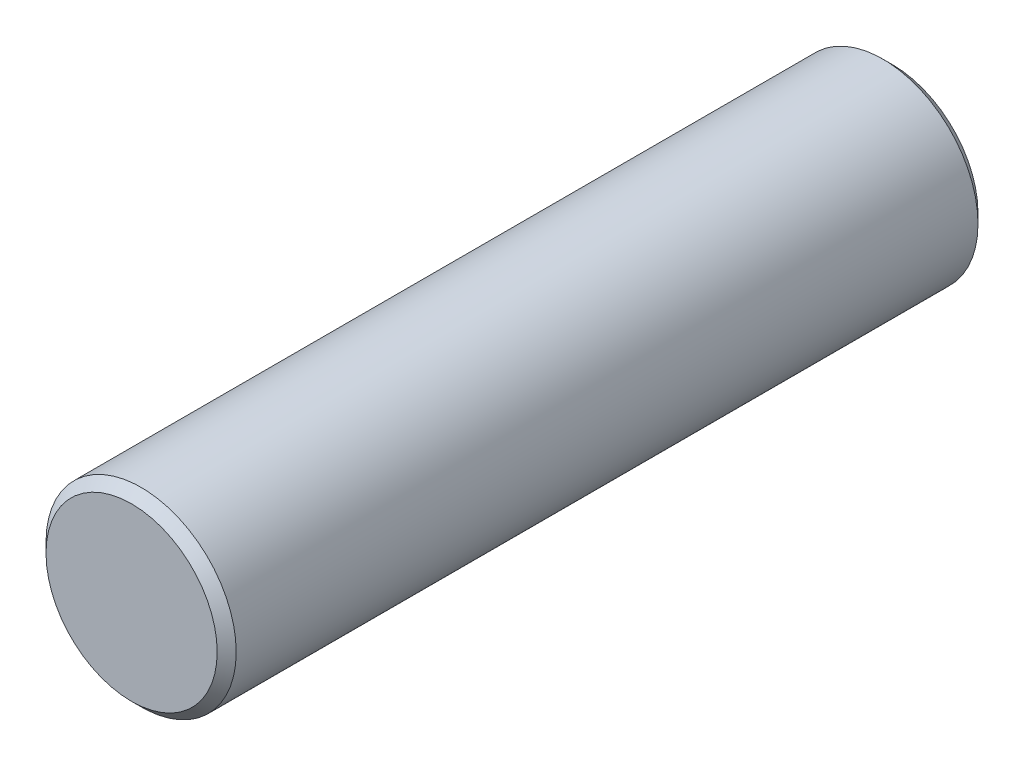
SolidWorks part; units mm, degrees
ref_plane "Płaszczyzna przednia" through (0, 0, 0) normal (0, 0, 1) x (1, 0, 0)
ref_plane "Płaszczyzna górna" through (0, 0, 0) normal (0, 1, 0) x (1, 0, 0)
ref_plane "Płaszczyzna prawa" through (0, 0, 0) normal (1, 0, 0) x (0, 0, -1)
sketch "Szkic1" plane through (0, 0, 0) normal (0, 0, 1) x (1, 0, 0)
  circle A0 centre (0, 0) radius 5
extrude "Dodanie-wyciągnięcie1" add sketch "Szkic1" along normal blind 40
chamfer "Sfazowanie1" distance 0.5 angle 45 2 edges at (5, 0, 0) (5, 0, 40)
